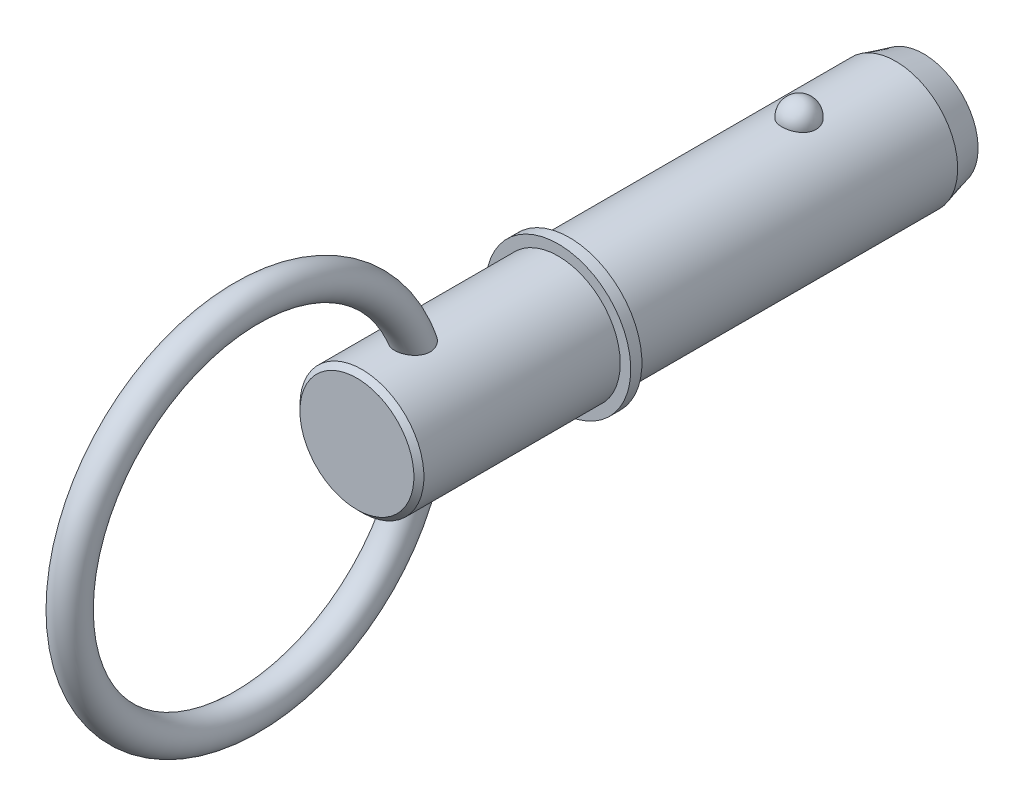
SolidWorks part; units mm, degrees
ref_plane "Front Plane" through (0, 0, 0) normal (0, 0, 1) x (1, 0, 0)
ref_plane "Top Plane" through (0, 0, 0) normal (0, 1, 0) x (1, 0, 0)
ref_plane "Right Plane" through (0, 0, 0) normal (1, 0, 0) x (0, 0, -1)
sketch "Sketch2" plane through (0, 0, 0) normal (0, 0, 1) x (1, 0, 0)
  circle A0 centre (0, 0) radius 11.115
  point P3 (0, 11.115)
  dimension "D1" = 22.23
extrude "Boss-Extrude1" add sketch "Sketch2" along normal blind 38.1
sketch "Sketch3" plane through (0, 0, 0) normal (0, 0, -1) x (-1, 0, 0)
  circle A0 centre (0, 0) radius 11.115
  dimension "D1" = 22.23
extrude "Boss-Extrude2" add sketch "Sketch3" along normal blind 25.4
chamfer "Chamfer1" distance 5 angle 15 1 edges at (-11.115, 0, -25.4)
sketch "Sketch18" plane through (0, 0, 0) normal (1, 0, 0) x (0, 0, -1)
  line L0 (20.4, 11.115) -> (-38.1, 11.115) construction
  line L1 (3.07, 14.185) -> (3.07, 8.045)
  line L2 (-38.1, -11.115) -> (20.4, -11.115) construction
  arc A0 (3.07, 14.185) -> (3.07, 8.045) centre (3.07, 11.115) ccw
  point P4 (0, 11.115)
  dimension "D1" = 25.3
revolve "Revolve1" add sketch "Sketch18" angle 360 about L1
sketch "Sketch19" plane through (0, 0, 0) normal (1, 0, 0) x (0, 0, -1)
  line L0 (-33.7288, 0) -> (-46.4542, 0) construction
sketch "Sketch20" plane through (0, 0, 0) normal (1, 0, 0) x (0, 0, -1)
  line L0 (-38.1, 0) -> (-38.1, 13)
  line L1 (-38.1, 11.115) -> (-38.1, -11.115) construction
  line L2 (-38.1, 13) -> (-40.1, 13)
  line L3 (-40.1, 13) -> (-40.1, 0)
  line L4 (-33.7288, 0) -> (-46.4542, 0) construction
  line L5 (-40.1, 0) -> (-38.1, 0)
  dimension "D1" = 13
  dimension "D2" = 2
revolve "Revolve2" add sketch "Sketch20" angle 360 about L0
sketch "Sketch21" plane through (0, 0, 38.1) normal (0, 0, -1) x (-1, 0, 0)
  circle A0 centre (0, 0) radius 11.115
  dimension "D1" = 22.23
extrude "Boss-Extrude3" add sketch "Sketch21" against normal blind 38.1
chamfer "Chamfer2" distance 0.9 angle 45 1 edges at (-11.115, 0, 76.2)
sketch "Sketch23" plane through (0, 0, 0) normal (1, 0, 0) x (0, 0, -1)
  line L0 (-76.2, 10.215) -> (-76.2, -10.215) construction
  circle A0 centre (-95.95, 0) radius 31.75
  point P2 (-64.2, 0)
  dimension "D1" = 63.5
  dimension "D2" = 12
sketch "Sketch24" plane through (0, 0, 0) normal (0, 1, 0) x (1, 0, 0)
  circle A0 centre (0, -64.2) radius 3
  dimension "D1" = 6
sweep "Sweep1" add profiles "Sketch24" path "Sketch23"
